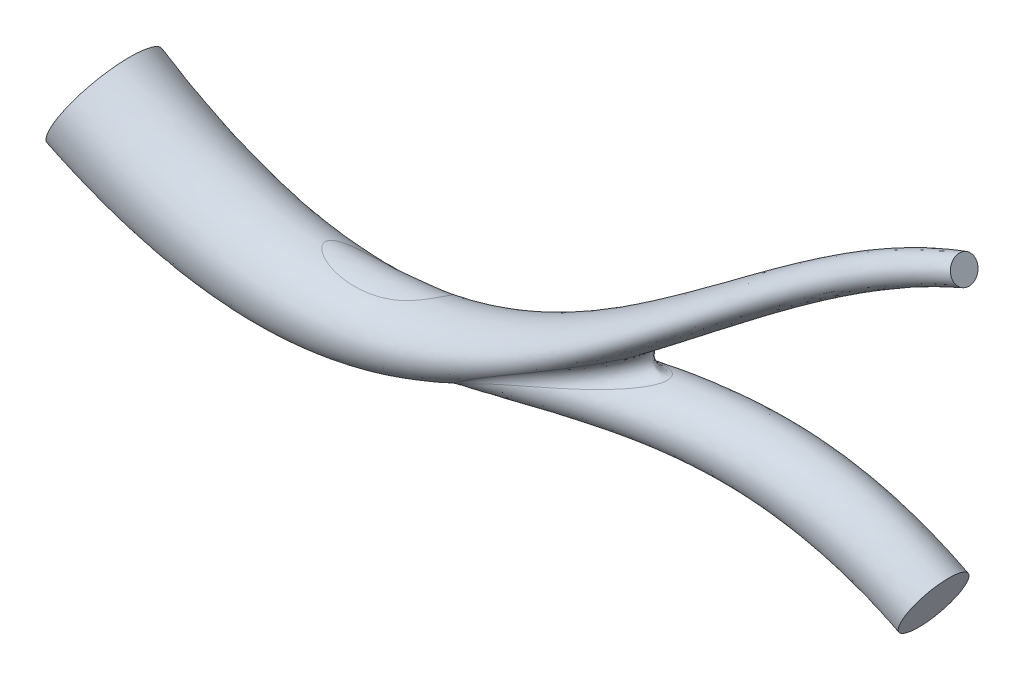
SolidWorks part; units mm, degrees
ref_plane "Ebene vorne" through (0, 0, 0) normal (0, 0, 1) x (1, 0, 0)
ref_plane "Ebene oben" through (0, 0, 0) normal (0, 1, 0) x (1, 0, 0)
ref_plane "Ebene rechts" through (0, 0, 0) normal (1, 0, 0) x (0, 0, -1)
sketch3d "3D-Skizze1"
  spline S0 degree 3 poles (0, 0, 0) (57.8498, -31.9989, 0) (88.2741, 25.1863, 0) (131.4065, 42.6566, 0) knots 0 0 0 0 1 1 1 1
ref_plane "Ebene1" through (0, 0, 0) normal (0.8751, -0.484, 0) x (0, 0, -1)
ref_plane "Ebene2" through (131.4065, 42.6566, 0) normal (0.9269, 0.3754, 0) x (0, 0, -1)
sketch "Skizze1" plane through (0, 0, 0) normal (0.8751, -0.484, 0) x (0, 0, -1)
  circle A0 centre (0, 0) radius 8.0386
sketch "Skizze2" plane through (131.4065, 42.6566, 0) normal (0.9269, 0.3754, 0) x (0, 0, -1)
  circle A0 centre (0, 0) radius 1.9747
loft "Ausformung1" add profiles "Skizze1", "Skizze2"
sketch3d "3D-Skizze2"
  spline S0 degree 3 poles (0, 0, 0) (50.2091, -24.7474, 0) (82.3897, 17.3939, 0) (125.5527, -4.9538, 0) knots 0 0 0 0 1 1 1 1
ref_plane "Ebene3" through (125.5527, -4.9538, 0) normal (0.888, -0.4598, 0) x (0, 0, -1)
sketch "Skizze3" plane through (0, 0, 0) normal (0.8751, -0.484, 0) x (0, 0, -1)
  circle A0 centre (0, 0) radius 5.3394
sketch "Skizze4" plane through (125.5527, -4.9538, 0) normal (0.888, -0.4598, 0) x (0, 0, -1)
  circle A0 centre (1.1732, 0) radius 4.9236
loft "Ausformung2" add profiles "Skizze3", "Skizze4"
fillet "Verrundung1" radius 2 1 edges at (53.9678, -8.9173, -3.9414)
